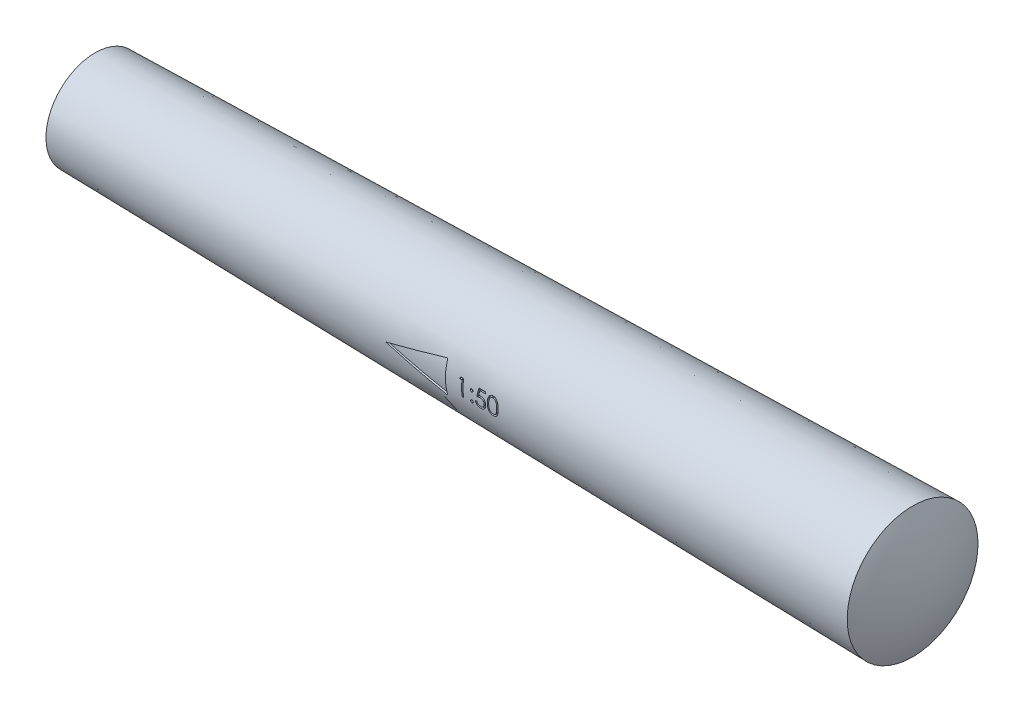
SolidWorks part; units mm, degrees
ref_plane "Front Plane" through (0, 0, 0) normal (0, 0, 1) x (1, 0, 0)
ref_plane "Top Plane" through (0, 0, 0) normal (0, 1, 0) x (1, 0, 0)
ref_plane "Right Plane" through (0, 0, 0) normal (1, 0, 0) x (0, 0, -1)
sketch "Sketch1" plane through (0, 0, 0) normal (1, 0, 0) x (0, 0, -1)
  circle A0 centre (0, 0) radius 3
  dimension "D1" = 6
extrude "Extrude1" add sketch "Sketch1" along normal mid plane 50
draft "Draft1" type of draft neutral plane draft angle 1.146 faces to draft 1 parameters "D1"=1.146
sketch "Sketch2" plane through (0, 0, 0) normal (0, 0, 1) x (1, 0, 0)
  line L0 (-25, 0) -> (-25, 3)
  line L1 (-25, 3) -> (-25, -3) construction
  line L2 (-25, 0) -> (-25.9, 0)
  line L3 (-25.9, 0) -> (-25.9, -3.5) construction
  line L4 (25, 0) -> (25, 4)
  line L5 (25, -4) -> (25, 4) construction
  line L6 (25, 0) -> (25.9, 0)
  line L7 (25.9, 0) -> (25.9, -3.5) construction
  line L8 (-25, -3) -> (25, -4) construction
  arc A0 (-25.9, 0) -> (-25, 3) centre (-20.45, 0) cw
  arc A1 (25.9, 0) -> (25, 4) centre (16.561, 0) ccw
  point P14 (0, -3.5)
revolve "Revolve1" add sketch "Sketch2" angle 360 about L2
sketch "Sketch5" plane through (0, 0, 0) normal (0, 0, 1) x (1, 0, 0)
  line L0 (0, 3.5) -> (0, -3.5) construction
  line L1 (25, 4) -> (-25, 3) construction
  line L2 (-25, -3) -> (25, -4) construction
ref_plane "Plane2" through (0, 0, 0) normal (-0.02, 0, 0.9998) x (0.9998, 0, 0.02)
sketch "Sketch6" plane through (0, 0, 0) normal (-0.02, 0, 0.9998) x (0.9998, 0, 0.02)
  line L0 (0, 0) -> (0, 1)
  line L1 (0, 3.5) -> (0, -3.5) construction
  line L2 (0, 1) -> (-3.7321, 0)
  line L3 (-3.7321, 0) -> (0, -1)
  line L4 (0, -1) -> (0, 0)
  line L5 (0, -0.5) -> (4, -0.5) construction
  text T0 "1:50" font "Century Gothic" height 1
  dimension "D1" = 2
  dimension "D2" = 30
  dimension "D3" = 4
wrap "Wrap2" sketch "Sketch6" wrap type deboss source sketch "Sketch6" thickness 0.1 parameters "D1"=0.1
equation "\"D2@Sketch2\" = \"D1@Sketch2\""
